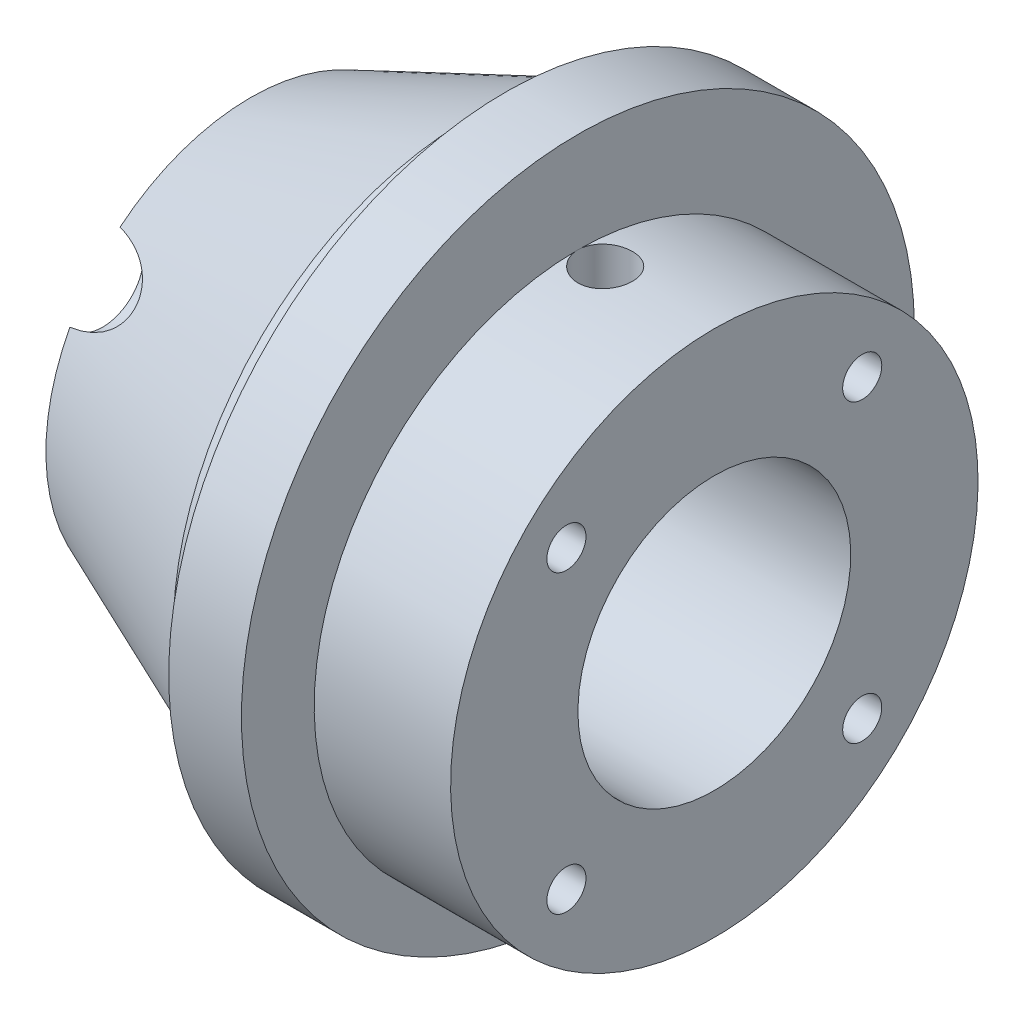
SolidWorks part; units mm, degrees
ref_plane "Face" through (0, 0, 0) normal (0, 0, 1) x (1, 0, 0)
ref_plane "Dessus" through (0, 0, 0) normal (0, 1, 0) x (1, 0, 0)
ref_plane "Droite" through (0, 0, 0) normal (1, 0, 0) x (0, 0, -1)
sketch "Esquisse2" plane through (0, 0, 0) normal (0, 0, 1) x (1, 0, 0)
  line L0 (0, 0) -> (0, 29)
  line L1 (0, 29) -> (-15, 29)
  line L2 (-15, 0) -> (-15, 29)
  line L3 (10, 0) -> (-20, 0) construction
  line L4 (-15, 0) -> (0, 0)
  dimension "D3" = 15
  dimension "D4" = 58
revolve "Base-Révolution" add sketch "Esquisse2" angle 360 about L3
sketch "Esquisse4" plane through (0, 0, 0) normal (0, 0, 1) x (1, 0, 0)
  line L0 (-51, 3) -> (-73.6764, 3) construction
  line L1 (-15, 3) -> (-15, 40)
  line L2 (-23, 35.5) -> (-27, 35.5)
  line L3 (-15, 40) -> (-23, 40)
  line L4 (-23, 40) -> (-23, 35.5)
  line L5 (-27, 35.5) -> (-51, 25.5)
  line L6 (-51, 25.5) -> (-51, 3)
  line L9 (-15, 3) -> (-51, 3)
  line L11 (-15, 0) -> (-15, 29) construction
  line L14 (10, 0) -> (-20, 0) construction
  dimension "D1" = 3
  dimension "D2" = 74
  dimension "D3" = 32.5
  dimension "D4" = 22.5
  dimension "D5" = 28
  dimension "D6" = 8
  dimension "D7" = 4
revolve "Boss.-Révol.1" add sketch "Esquisse4" angle 360 about L0
sketch "Esquisse6" plane through (-51, 0, 0) normal (-1, 0, 0) x (0, 0, 1)
  line L0 (0, 0) -> (0, 41.2311) construction
  line L1 (0, 0) -> (-28.3728, 28.3728) construction
  circle A0 centre (0, 0) radius 23 construction
  circle A2 centre (-16.2635, 16.2635) radius 4.5
  dimension "D1" = 9
  dimension "D2" = 45
  dimension "D3" = 46
extrude "Enlèv. mat.-Extru.1" cut sketch "Esquisse6" against normal blind 15
sketch "Esquisse7" plane through (-36, 0, 0) normal (-1, 0, 0) x (0, 0, 1)
  circle A0 centre (-16.2635, 16.2635) radius 2.15
  dimension "D1" = 4.3
extrude "Enlèv. mat.-Extru.2" cut sketch "Esquisse7" against normal through all
pattern_circular "Répétition circulaire1" count 4 every 90 about axis through (10, 0, 0) along (-1, 0, 0)
sketch "Esquisse12" plane through (0, 0, 0) normal (0, 0, 1) x (1, 0, 0)
  line L0 (-15, 40) -> (-23, 40)
  line L1 (-15, 40) -> (-23, 40)
  line L2 (-23, -34) -> (-15, -34)
  line L3 (-23, -34) -> (-15, -34)
  line L4 (-23, -29.5) -> (-23, -34)
  line L5 (-23, -29.5) -> (-23, -34)
  line L6 (-23, 40) -> (-23, 35.5)
  line L7 (-23, 40) -> (-23, 35.5)
  line L8 (-23, 35.5) -> (-27, 35.5)
  line L9 (-23, 35.5) -> (-27, 35.5)
  line L10 (-27, -29.5) -> (-23, -29.5)
  line L11 (-27, -29.5) -> (-23, -29.5)
  line L12 (0, 3) -> (-50, 3) construction
sketch "Esquisse13" plane through (0, 0, 0) normal (0, 0, 1) x (1, 0, 0)
  line L0 (3, 0) -> (3, 15)
  line L1 (-55, 0) -> (195, 0) construction
  line L2 (3, 15) -> (-25, 15)
  line L3 (-25, 15) -> (-25, 16)
  line L4 (-25, 16) -> (-51, 16)
  line L5 (-51, 25.5) -> (-51, 3) construction
  line L6 (-51, 16) -> (-51, 0)
  line L7 (-51, 0) -> (3, 0)
  line L8 (3, 6) -> (3, 0) construction
  line L9 (-31.7, 16) -> (-25.3, 16) construction
  line L10 (-25, 15.7) -> (-25, 10.3) construction
  line L11 (3, 0) -> (-62.1937, 0) construction
  dimension "D1" = 1
revolve "Enlèvement de matière-Révolution1" cut sketch "Esquisse13" angle 360 about L11
sketch "Esquisse14" plane through (0, 0, 0) normal (0, 0, 1) x (1, 0, 0)
  line L0 (-44.6643, 0) -> (-50.0344, 0) construction
  line L1 (-49.8, 16) -> (-48.4, 16)
  line L2 (-49.8, 16) -> (-49.8, 16.85)
  line L3 (-49.8, 16.85) -> (-48.4, 16.85)
  line L4 (-48.4, 16) -> (-48.4, 16.85)
  line L5 (-55, 0) -> (195, 0) construction
  line L6 (-48.2, 16) -> (-41.8, 16) construction
  line L7 (-48.5, 15.7) -> (-48.5, 10.3) construction
  dimension "D1" = 33.7
  dimension "D2" = 0.1
  dimension "D3" = 1.3
revolve "Enlèvement de matière-Révolution2" cut sketch "Esquisse14" angle 360 about L0
sketch "Esquisse15" plane through (0, 0, 0) normal (0, 0, 1) x (1, 0, 0)
  line L0 (0, 3) -> (-50, 3) construction
  line L1 (-9, 35.5) -> (-12, 35.5)
  line L2 (-9, 35.5) -> (-9, 3)
  line L3 (-9, 3) -> (-12, 3)
  line L4 (-12, 35.5) -> (-12, 3)
  line L5 (-12, 5.5) -> (-12, 10) construction
  line L6 (-9, 5.5) -> (-9, 10.9) construction
  line L7 (-23, 35.5) -> (-27, 35.5) construction
  line L8 (-12, 35.5) -> (-12, 14.9299) construction
revolve "Enlèvement de matière-Révolution3" cut sketch "Esquisse15" angle 360 about L8
